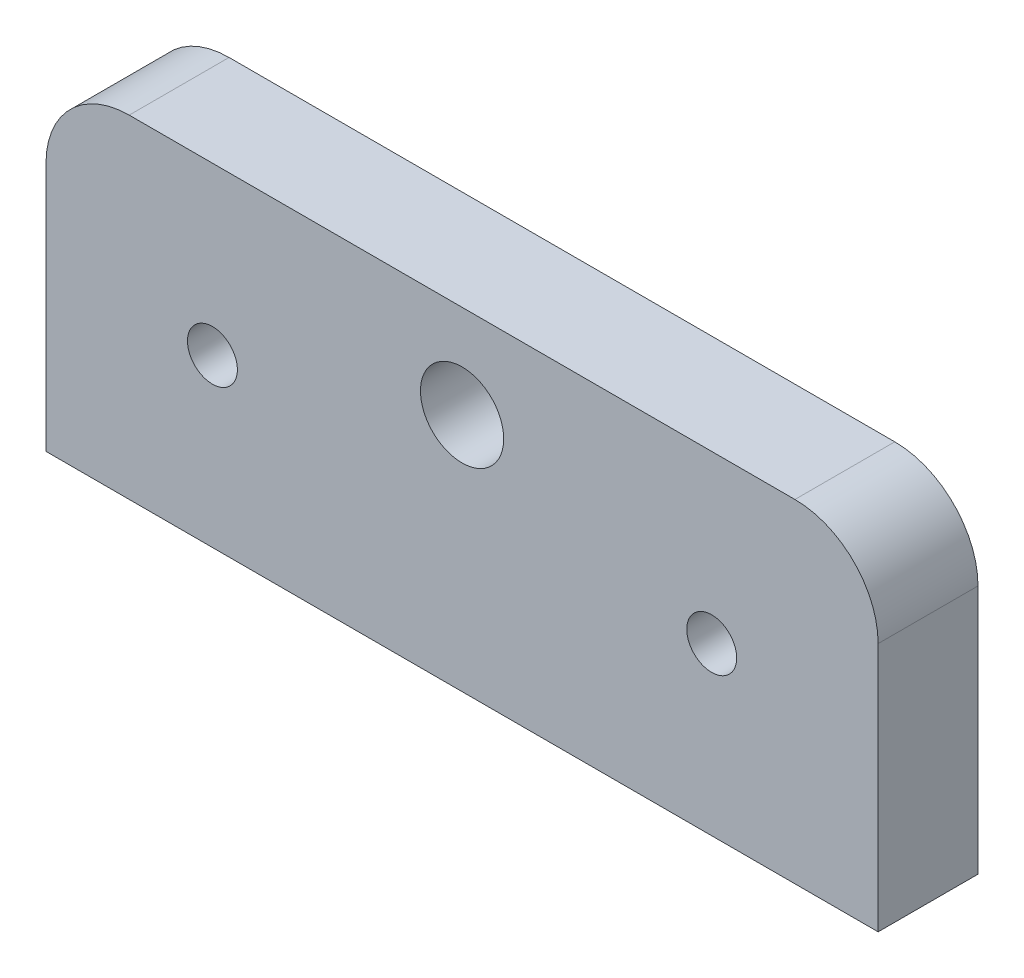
SolidWorks part; units mm, degrees
ref_plane "Face" through (0, 0, 0) normal (0, 0, 1) x (1, 0, 0)
ref_plane "Dessus" through (0, 0, 0) normal (0, 1, 0) x (1, 0, 0)
ref_plane "Droite" through (0, 0, 0) normal (1, 0, 0) x (0, 0, -1)
sketch "Esquisse1" plane through (0, 0, 0) normal (0, 0, 1) x (1, 0, 0)
  line L1 (-59.0387, -15.8683) -> (-9.0387, -15.8683)
  line L2 (-59.0387, -15.8683) -> (-59.0387, -35.8683)
  line L3 (-59.0387, -35.8683) -> (-9.0387, -35.8683)
  line L4 (-9.0387, -15.8683) -> (-9.0387, -35.8683)
  dimension "D1" = 20
  dimension "D2" = 50
extrude "Extrusion1" add sketch "Esquisse1" along normal blind 6
sketch "Esquisse2" plane through (0, 0, 6) normal (0, 0, 1) x (1, 0, 0)
  line L0 (-59.0387, -15.8683) -> (-59.0387, -35.8683) construction
  line L1 (-59.0387, -35.8683) -> (-9.0387, -35.8683) construction
  circle A0 centre (-34.0387, -21.4683) radius 2.5
  circle A1 centre (-19.0387, -25.8683) radius 1.5
  circle A2 centre (-49.0387, -25.8683) radius 1.5
  dimension "D3" = 15
  dimension "D1" = 25
  dimension "D2" = 14.4
  dimension "D4" = 15
  dimension "D5" = 10
  dimension "D6" = 10
extrude "Enlèv. mat.-Extru.1" cut sketch "Esquisse2" against normal up to vertex (6 mm away)
fillet "Congé1" radius 5 2 edges at (-9.0387, -15.8683, 3) (-59.0387, -15.8683, 3)
